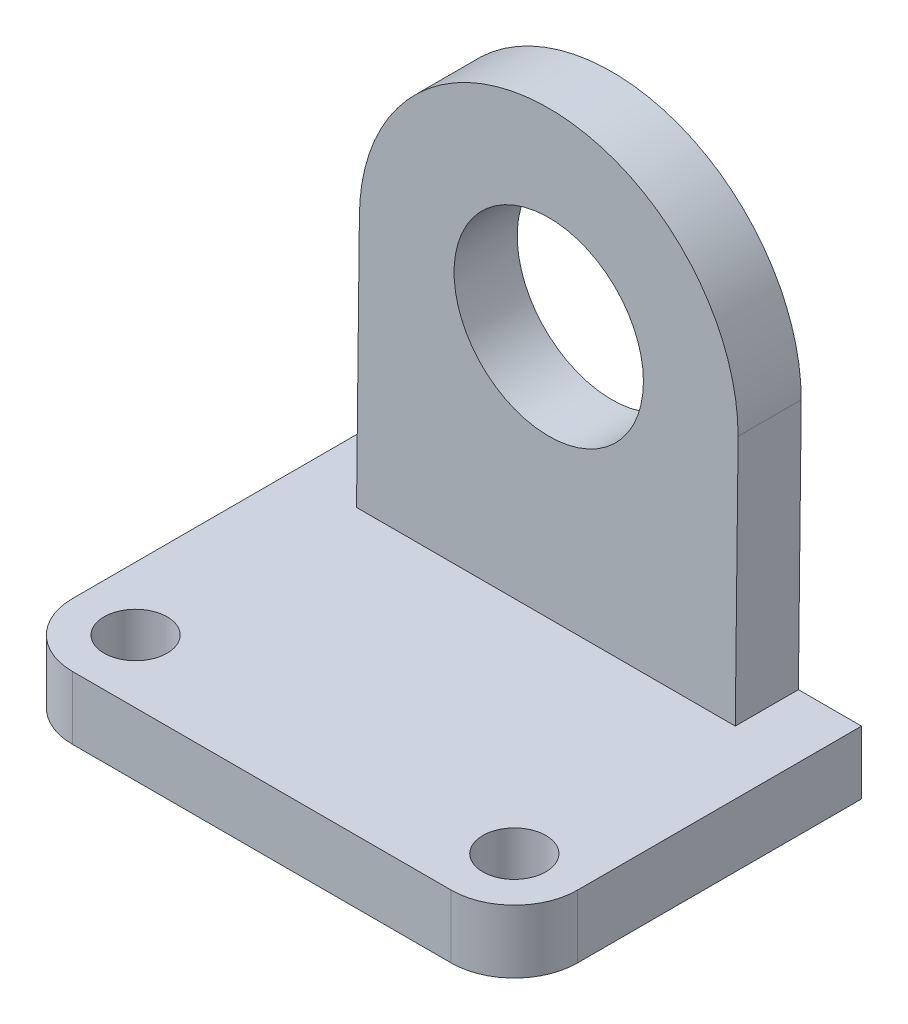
SolidWorks part; units mm, degrees
ref_plane "前视基准面" through (0, 0, 0) normal (0, 0, 1) x (1, 0, 0)
ref_plane "上视基准面" through (0, 0, 0) normal (0, 1, 0) x (1, 0, 0)
ref_plane "右视基准面" through (0, 0, 0) normal (1, 0, 0) x (0, 0, -1)
sketch "草图1" plane through (0, 0, 0) normal (0, 1, 0) x (1, 0, 0)
  line L0 (0, 0) -> (0, -69.2948) construction
  line L1 (40, 0) -> (-40, 0)
  line L2 (-40, 0) -> (-40, -45)
  line L3 (-30, -55) -> (30, -55)
  line L4 (40, 0) -> (40, -45)
  arc A0 (-30, -55) -> (-40, -45) centre (-30, -45) cw
  circle A1 centre (-30, -45) radius 5
  arc A2 (30, -55) -> (40, -45) centre (30, -45) ccw
  circle A3 centre (30, -45) radius 5
  point P9 (-40, -55)
  point P15 (0, -55)
  point P16 (0, 0)
  dimension "D3" = 10
  dimension "D4" = 10
  dimension "D1" = 40
  dimension "D2" = 55
extrude "凸台-拉伸1" add sketch "草图1" along normal blind 10
sketch "草图2" plane through (0, 0, 0) normal (0, 0, 1) x (1, 0, 0)
  line L0 (0, -5.3852) -> (0, 86.7374) construction
  line L1 (-43.2807, 50) -> (44.1855, 50) construction
  line L2 (-29.5476, 50) -> (-30, 10)
  line L3 (-30, 10) -> (30, 10)
  line L4 (30, 10) -> (30.4524, 50)
  arc A0 (-29.5476, 50) -> (30.4524, 50) centre (0.4524, 50) cw
  circle A1 centre (0.4524, 50) radius 15
  dimension "D2" = 30
  dimension "D3" = 30
  dimension "D1" = 40
extrude "凸台-拉伸2" add sketch "草图2" along normal blind 10
sketch "草图3" plane through (0, 0, 10) normal (0, 0, 1) x (1, 0, 0)
  line L0 (0.4524, 73.0549) -> (0.4524, 5.8978) construction
  line L1 (-4.5476, 30.6351) -> (-4.5476, 10)
  line L2 (-30, 10) -> (30, 10) construction
  line L3 (-4.5476, 10) -> (5.4524, 10)
  line L5 (5.4524, 30.6351) -> (5.4524, 10)
  arc A0 (5.4524, 30.6351) -> (-4.5476, 30.6351) centre (0.4524, 50) ccw
  circle A1 centre (0.4524, 50) radius 15
  dimension "D1" = 40
  dimension "D2" = 30
  dimension "D3" = 5
